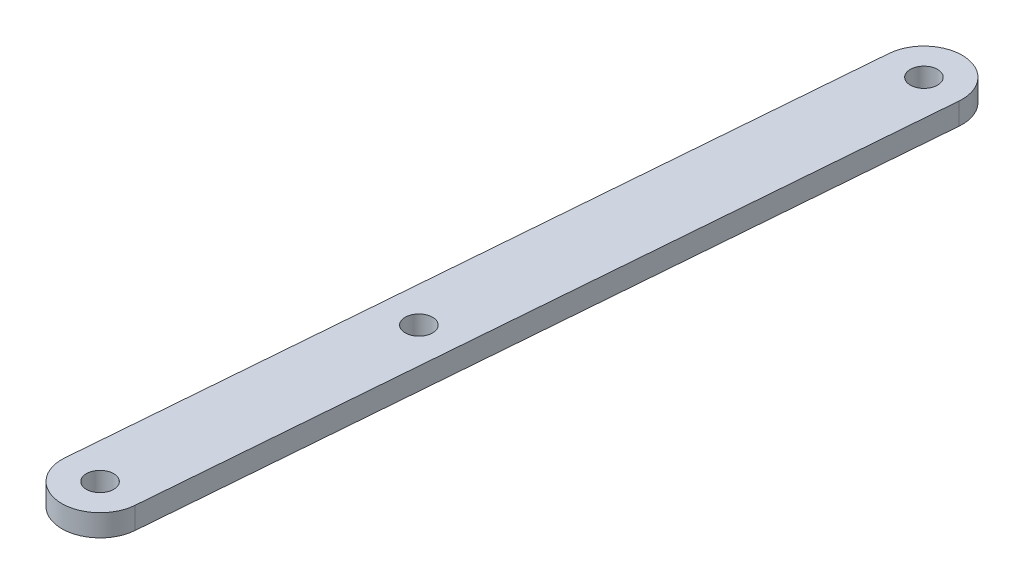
SolidWorks part; units mm, degrees
ref_plane "Front Plane" through (0, 0, 0) normal (0, 0, 1) x (1, 0, 0)
ref_plane "Top Plane" through (0, 0, 0) normal (0, 1, 0) x (1, 0, 0)
ref_plane "Right Plane" through (0, 0, 0) normal (1, 0, 0) x (0, 0, -1)
sketch "Sketch1" plane through (0, 7.62, 0) normal (0, 1, 0) x (1, 0, 0)
  line L0 (71.0987, 31.6604) -> (78.2916, 120.2689) construction
  line L1 (66.6683, 32.02) -> (73.8612, 120.6286)
  line L2 (75.5291, 31.3007) -> (82.7221, 119.9093)
  arc A0 (66.6683, 32.02) -> (75.5291, 31.3007) centre (71.0987, 31.6604) ccw
  arc A1 (82.7221, 119.9093) -> (73.8612, 120.6286) centre (78.2916, 120.2689) ccw
  circle A2 centre (73.8822, 65.9504) radius 1.5875
  circle A3 centre (71.0987, 31.6604) radius 1.5875
  point P3 (74.6952, 75.9647)
  dimension "D1" = 3.175
  dimension "D2" = 34.29
extrude "Extrude1" add sketch "Sketch1" along normal blind 2.54
sketch "Sketch2" plane through (0, 10.16, 0) normal (0, 1, 0) x (1, 0, 0)
  circle A0 centre (78.2916, 120.2689) radius 1.5875
  dimension "D1" = 3.175
extrude "Cut-Extrude1" cut sketch "Sketch2" against normal through all
